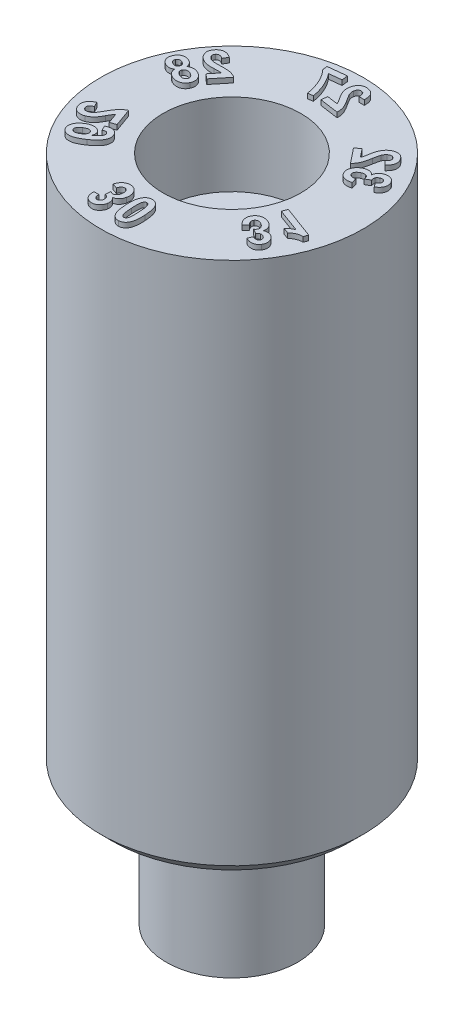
SolidWorks part; units mm, degrees
other "<M8L16-SetScrew>-<Chamfer1>" parameters "D10"=0.75
ref_plane "Front Plane" through (0, 0, 0) normal (0, 0, 1) x (1, 0, 0)
ref_plane "Top Plane" through (0, 0, 0) normal (0, 1, 0) x (1, 0, 0)
ref_plane "Right Plane" through (0, 0, 0) normal (1, 0, 0) x (0, 0, -1)
sketch "Sketch1" plane through (0, 0, 0) normal (0, 0, 1) x (1, 0, 0)
  line L0 (0, 0) -> (0, 20) construction
  line L1 (0, -8.8) -> (0, 8.8) construction
  line L2 (4, -32.7) -> (7.25, -32.7)
  line L4 (8, -31.95) -> (8, 0)
  line L5 (8, 0) -> (4.2, 0)
  line L6 (4.2, 0) -> (4.2, -5)
  line L7 (4.2, -5) -> (1.75, -5)
  line L8 (1.75, -5) -> (1.75, -22.7)
  line L9 (1.75, -22.7) -> (4, -22.7)
  line L10 (4, -22.7) -> (4, -32.7)
  line L11 (7.25, -32.7) -> (8, -31.95)
  point P6 (8, -32.7)
  dimension "D1" = 5
  dimension "D2" = 10
  dimension "D3" = 3.5
  dimension "D4" = 8.4
  dimension "D5" = 16
  dimension "D6" = 8
  dimension "D7" = 32.7
revolve "Revolve1" add sketch "Sketch1" angle 360 about L0
sketch "Sketch2" plane through (0, 0, 0) normal (0, 1, 0) x (1, 0, 0)
  line L0 (0, 0) -> (0, 8.4189) construction
  line L1 (0, 0) -> (7.291, 4.2094) construction
  line L2 (0, 0) -> (7.291, -4.2094) construction
  line L3 (0, 0) -> (0, -8.4189) construction
  line L4 (0, 0) -> (-7.291, -4.2094) construction
  line L5 (0, 0) -> (-7.291, 4.2094) construction
  arc A0 (1.395, 5.0613) -> (3.3864, 4.0119) centre (0, 0) ccw construction
  text T0 "27    28    29    30     31    32" font "Arial Narrow" height 2.1
  point P13 (0, 0)
  point P16 (0, 0)
  point P17 (0, 0)
  point P21 (0, 0)
  dimension "D1" = 10.5
  dimension "D2" = 6
extrude "Boss-Extrude1" add sketch "Sketch2" along normal blind 0.3
inserted part "M8L16-SetScrew"
move or copy body "Body-Move/Copy2" placed by mates yes
other "Distance1" parameters "D1"=8
